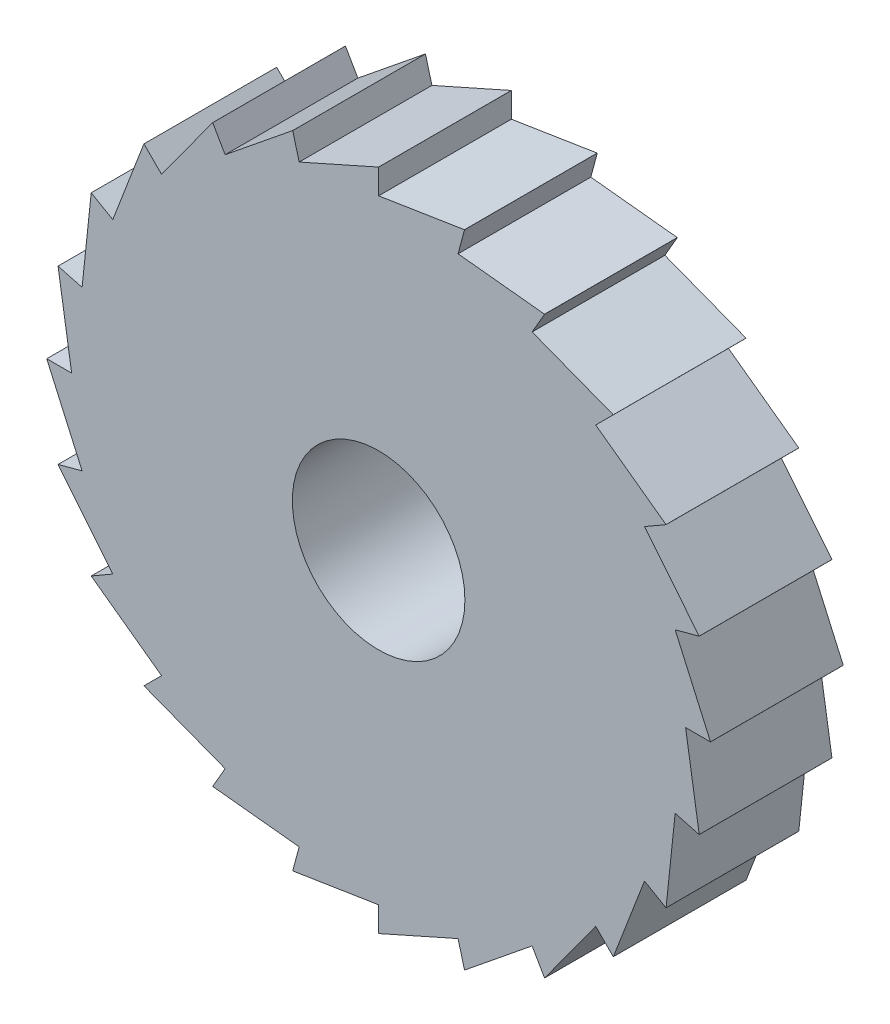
SolidWorks part; units mm, degrees
ref_plane "Спереди" through (0, 0, 0) normal (0, 0, 1) x (1, 0, 0)
ref_plane "Сверху" through (0, 0, 0) normal (0, 1, 0) x (1, 0, 0)
ref_plane "Справа" through (0, 0, 0) normal (1, 0, 0) x (0, 0, -1)
sketch "Эскиз2" plane through (0, 0, 0) normal (0, 0, 1) x (1, 0, 0)
  line L0 (0, 25) -> (0, 0) construction
  line L1 (0, 0) -> (-6.4705, 24.1481) construction
  line L2 (0, 25) -> (0, 23.125)
  line L3 (0, 23.125) -> (6.4665, 24.1492)
  line L4 (0, 0) -> (6.4705, 24.1481) construction
  line L5 (6.4705, 24.1481) -> (5.9852, 22.337)
  line L6 (5.9852, 22.337) -> (12.4965, 21.6527)
  line L7 (12.5, 21.6506) -> (11.5625, 20.0268)
  line L8 (11.5625, 20.0268) -> (17.6748, 17.6805)
  line L9 (17.6777, 17.6777) -> (16.3518, 16.3518)
  line L10 (16.3518, 16.3518) -> (21.6486, 12.5035)
  line L11 (21.6506, 12.5) -> (20.0268, 11.5625)
  line L12 (20.0268, 11.5625) -> (24.1471, 6.4744)
  line L13 (24.1481, 6.4705) -> (22.337, 5.9852)
  line L14 (22.337, 5.9852) -> (25, 0.0041)
  line L15 (25, 0) -> (23.125, 0)
  line L16 (23.125, 0) -> (24.1492, -6.4665)
  line L17 (24.1481, -6.4705) -> (22.337, -5.9852)
  line L18 (22.337, -5.9852) -> (21.6527, -12.4965)
  line L19 (21.6506, -12.5) -> (20.0268, -11.5625)
  line L20 (20.0268, -11.5625) -> (17.6805, -17.6748)
  line L21 (17.6777, -17.6777) -> (16.3518, -16.3518)
  line L22 (16.3518, -16.3518) -> (12.5035, -21.6486)
  line L23 (12.5, -21.6506) -> (11.5625, -20.0268)
  line L24 (11.5625, -20.0268) -> (6.4744, -24.1471)
  line L25 (6.4705, -24.1481) -> (5.9852, -22.337)
  line L26 (5.9852, -22.337) -> (0.0041, -25)
  line L27 (0, -25) -> (0, -23.125)
  line L28 (0, -23.125) -> (-6.4665, -24.1492)
  line L29 (-6.4705, -24.1481) -> (-5.9852, -22.337)
  line L30 (-5.9852, -22.337) -> (-12.4965, -21.6527)
  line L31 (-12.5, -21.6506) -> (-11.5625, -20.0268)
  line L32 (-11.5625, -20.0268) -> (-17.6748, -17.6805)
  line L33 (-17.6777, -17.6777) -> (-16.3518, -16.3518)
  line L34 (-16.3518, -16.3518) -> (-21.6486, -12.5035)
  line L35 (-21.6506, -12.5) -> (-20.0268, -11.5625)
  line L36 (-20.0268, -11.5625) -> (-24.1471, -6.4744)
  line L37 (-24.1481, -6.4705) -> (-22.337, -5.9852)
  line L38 (-22.337, -5.9852) -> (-25, -0.0041)
  line L39 (-25, 0) -> (-23.125, 0)
  line L40 (-23.125, 0) -> (-24.1492, 6.4665)
  line L41 (-24.1481, 6.4705) -> (-22.337, 5.9852)
  line L42 (-22.337, 5.9852) -> (-21.6527, 12.4965)
  line L43 (-21.6506, 12.5) -> (-20.0268, 11.5625)
  line L44 (-20.0268, 11.5625) -> (-17.6805, 17.6748)
  line L45 (-17.6777, 17.6777) -> (-16.3518, 16.3518)
  line L46 (-16.3518, 16.3518) -> (-12.5035, 21.6486)
  line L47 (-12.5, 21.6506) -> (-11.5625, 20.0268)
  line L48 (-11.5625, 20.0268) -> (-6.4744, 24.1471)
  line L49 (-6.4705, 24.1481) -> (-5.9852, 22.337)
  line L50 (-5.9852, 22.337) -> (-0.0041, 25)
  circle A0 centre (0, 0) radius 6.5
  arc A1 (-6.4705, 24.1481) -> (-6.4744, 24.1471) centre (0, 0) ccw
  circle A2 centre (0, 0) radius 23.125 construction
  arc A3 (0, 25) -> (-0.0041, 25) centre (0, 0) ccw
  arc A4 (-12.5, 21.6506) -> (-12.5035, 21.6486) centre (0, 0) ccw
  arc A5 (-17.6777, 17.6777) -> (-17.6805, 17.6748) centre (0, 0) ccw
  arc A6 (-21.6506, 12.5) -> (-21.6527, 12.4965) centre (0, 0) ccw
  arc A7 (-24.1481, 6.4705) -> (-24.1492, 6.4665) centre (0, 0) ccw
  arc A8 (-25, 0) -> (-25, -0.0041) centre (0, 0) ccw
  arc A9 (-24.1481, -6.4705) -> (-24.1471, -6.4744) centre (0, 0) ccw
  arc A10 (-21.6506, -12.5) -> (-21.6486, -12.5035) centre (0, 0) ccw
  arc A11 (-17.6777, -17.6777) -> (-17.6748, -17.6805) centre (0, 0) ccw
  arc A12 (-12.5, -21.6506) -> (-12.4965, -21.6527) centre (0, 0) ccw
  arc A13 (-6.4705, -24.1481) -> (-6.4665, -24.1492) centre (0, 0) ccw
  arc A14 (0, -25) -> (0.0041, -25) centre (0, 0) ccw
  arc A15 (6.4705, -24.1481) -> (6.4744, -24.1471) centre (0, 0) ccw
  arc A16 (12.5, -21.6506) -> (12.5035, -21.6486) centre (0, 0) ccw
  arc A17 (17.6777, -17.6777) -> (17.6805, -17.6748) centre (0, 0) ccw
  arc A18 (21.6506, -12.5) -> (21.6527, -12.4965) centre (0, 0) ccw
  arc A19 (24.1481, -6.4705) -> (24.1492, -6.4665) centre (0, 0) ccw
  arc A20 (25, 0) -> (25, 0.0041) centre (0, 0) ccw
  arc A21 (24.1481, 6.4705) -> (24.1471, 6.4744) centre (0, 0) ccw
  arc A22 (21.6506, 12.5) -> (21.6486, 12.5035) centre (0, 0) ccw
  arc A23 (17.6777, 17.6777) -> (17.6748, 17.6805) centre (0, 0) ccw
  arc A24 (12.5, 21.6506) -> (12.4965, 21.6527) centre (0, 0) ccw
  arc A25 (6.4705, 24.1481) -> (6.4665, 24.1492) centre (0, 0) ccw
  dimension "D1" = 13
  dimension "D2" = 50
  dimension "D3" = 46.25
  dimension "D4" = 15
  dimension "D5" = 81
  dimension "D6" = 1.875
  dimension "D8" = 15
  dimension "D7" = 24
extrude "Бобышка-Вытянуть2" add sketch "Эскиз2" along normal blind 10
